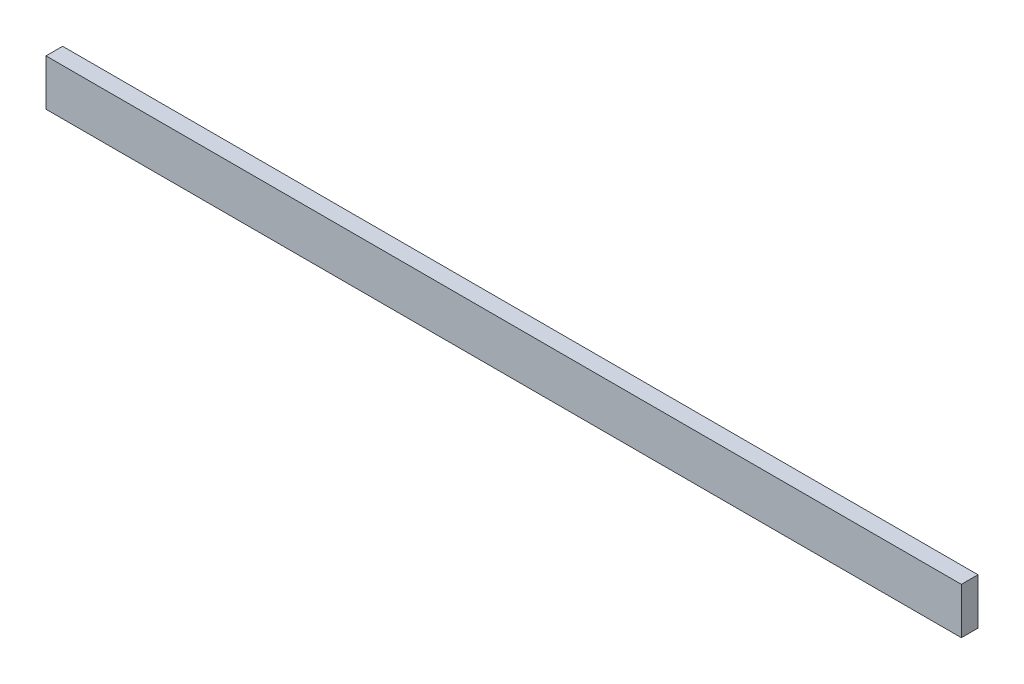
SolidWorks part; units mm, degrees
ref_plane "Plano frontal" through (0, 0, 0) normal (0, 0, 1) x (1, 0, 0)
ref_plane "Plano superior" through (0, 0, 0) normal (0, 1, 0) x (1, 0, 0)
ref_plane "Plano direito" through (0, 0, 0) normal (1, 0, 0) x (0, 0, -1)
sketch "Esboço1" plane through (0, 0, 0) normal (0, 0, 1) x (1, 0, 0)
  line L0 (-1028, 582) -> (48972, 582) construction
  line L1 (-1028, 632) -> (48972, 632) construction
  line L2 (-1018, -400.4634) -> (-1018, 49599.5366) construction
  line L4 (-28, -322.2893) -> (-28, 49677.7107) construction
  line L7 (-1018, 632) -> (-28, 632)
  line L8 (-1018, 632) -> (-1018, 582)
  line L9 (-1018, 582) -> (-28, 582)
  line L10 (-28, 632) -> (-28, 582)
  line L11 (-1018, 632) -> (-28, 582) construction
  line L12 (-1018, 582) -> (-28, 632) construction
  point P13 (-523, 607)
  dimension "D1" = 50
extrude "Ressalto-extrusão1" add sketch "Esboço1" against normal blind 18
